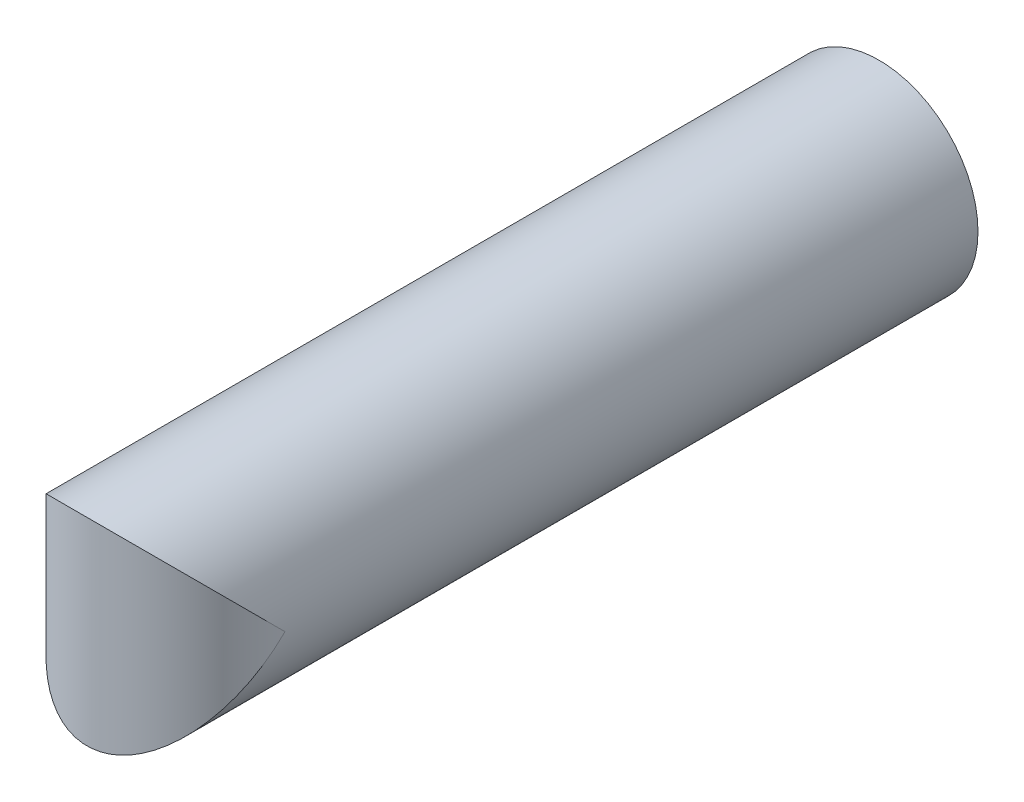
SolidWorks part; units mm, degrees
ref_plane "Face" through (0, 0, 0) normal (0, 0, 1) x (1, 0, 0)
ref_plane "Dessus" through (0, 0, 0) normal (0, 1, 0) x (1, 0, 0)
ref_plane "Droite" through (0, 0, 0) normal (1, 0, 0) x (0, 0, -1)
sketch "Esquisse1" plane through (0, 0, 0) normal (0, 0, 1) x (1, 0, 0)
  circle A0 centre (0, 0) radius 2.5
  dimension "D1" = 5
extrude "Base-Extrusion" add sketch "Esquisse1" along normal blind 20
sketch "Esquisse2" plane through (0, 0, 0) normal (0, 1, 0) x (1, 0, 0)
  line L0 (0, -20) -> (0, 0) construction
  line L1 (2.5, -20) -> (2.5, 0) construction
  line L2 (-2.5, -20) -> (2.5, -20) construction
  line L3 (0, 0) -> (0, -20) construction
  line L4 (-2.5, -20.7247) -> (2.5, -20.7247)
  line L5 (2.5, -20.7247) -> (2.5, -17.5)
  line L6 (-2.5, 0) -> (-2.5, -20) construction
  line L7 (-2.5, -17.5) -> (-2.5, -20.7247)
  arc A0 (-2.5, -17.5) -> (2.5, -17.5) centre (0, -17.5) ccw
extrude "Enlèv. mat.-Extru.1" cut sketch "Esquisse2" against normal through all and the other way through all
